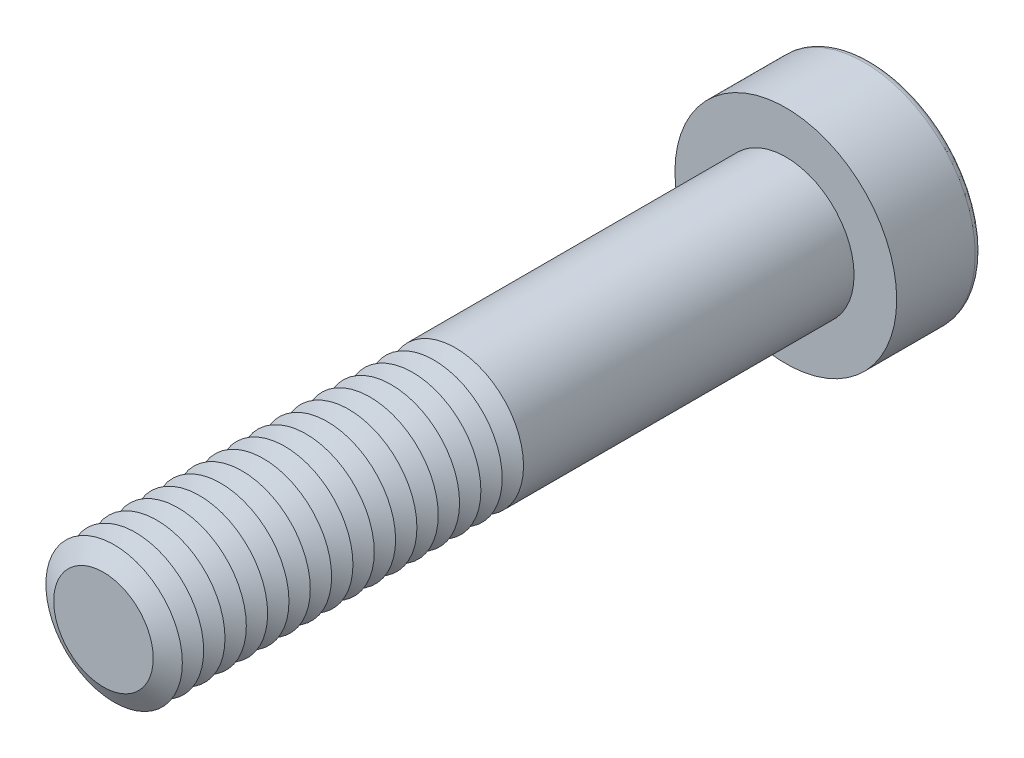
SolidWorks part; units mm, degrees
ref_plane "Front Plane" through (0, 0, 0) normal (0, 0, 1) x (1, 0, 0)
ref_plane "Top Plane" through (0, 0, 0) normal (0, 1, 0) x (1, 0, 0)
ref_plane "Right Plane" through (0, 0, 0) normal (1, 0, 0) x (0, 0, -1)
sketch "Sketch1" plane through (0, 0, 0) normal (0, 0, 1) x (1, 0, 0)
  circle A0 centre (0, 0) radius 4
  dimension "D1" = 8
extrude "Boss-Extrude1" add sketch "Sketch1" along normal blind 40
sketch "Sketch2" plane through (0, 0, 0) normal (0, 0, -1) x (-1, 0, 0)
  circle A0 centre (0, 0) radius 6.5
  dimension "D1" = 13
extrude "Boss-Extrude2" add sketch "Sketch2" along normal blind 5
sketch "Sketch3" plane through (0, 0, -5) normal (0, 0, -1) x (-1, 0, 0)
  line L1 (-1.4434, 2.5) -> (-2.8868, 0)
  line L2 (-2.8868, 0) -> (-1.4434, -2.5)
  line L3 (-1.4434, -2.5) -> (1.4434, -2.5)
  line L4 (1.4434, -2.5) -> (2.8868, 0)
  line L5 (2.8868, 0) -> (1.4434, 2.5)
  line L6 (1.4434, 2.5) -> (-1.4434, 2.5)
  circle A0 centre (0, 0) radius 2.5 construction
  dimension "D1" = 5
extrude "Cut-Extrude1" cut sketch "Sketch3" against normal blind 3.75
fillet "Fillet1" radius 0.4 1 edges at (-6.5, 0, -5)
sketch "Sketch4" plane through (0, 0, -1.25) normal (0, 0, -1) x (-1, 0, 0)
  line L0 (1.4434, -2.5) -> (2.8868, 0) construction
  circle A0 centre (0, 0) radius 2.5
extrude "Cut-Extrude2" cut sketch "Sketch4" against normal through all draft 60
sketch "Sketch5" plane through (0, 0, -5) normal (0, 0, -1) x (-1, 0, 0)
  circle A0 centre (0, 0) radius 2.8868
extrude "Cut-Extrude3" cut sketch "Sketch5" against normal through all draft 75
sketch "Sketch7" plane through (0, 0, 0) normal (1, 0, 0) x (0, 0, -1)
  line L25 (-40, 2.9175) -> (-39.375, 4)
  line L26 (-40, 4) -> (-40, -4) construction
  line L27 (-39.375, 4) -> (-40.625, 4)
  line L28 (-40.625, 4) -> (-40, 2.9175)
  line L29 (0, 4) -> (-40, 4) construction
  dimension "D1" = 1.25
revolve "Cut-Revolve1" cut sketch "Sketch7" angle 360 about axis through (0, 0, 40) along (0, 0, -1)
pattern_linear "LPattern1" count 17 spacing 1.25 along (0, 0, -1) of "Cut-Revolve1"
